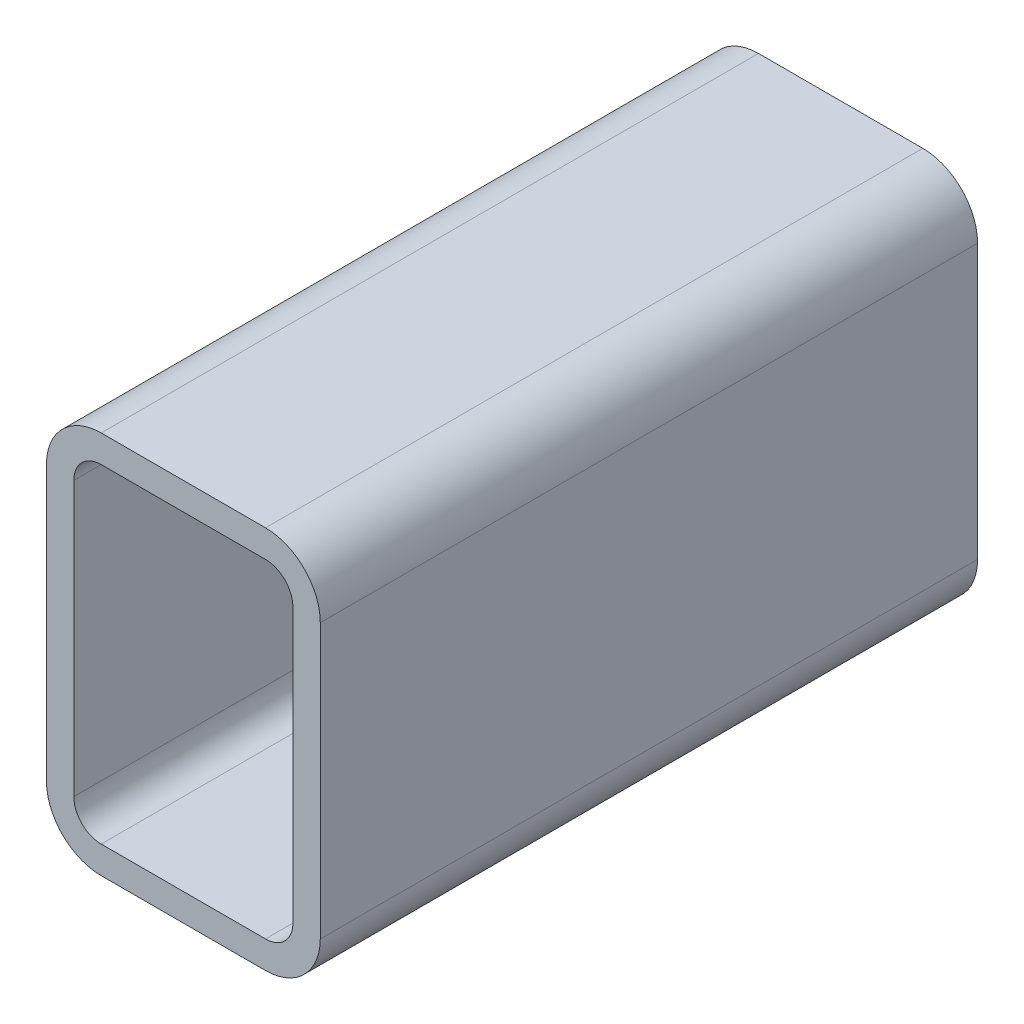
SolidWorks part; units mm, degrees
ref_plane "Front Plane" through (0, 0, 0) normal (0, 0, 1) x (1, 0, 0)
ref_plane "Top Plane" through (0, 0, 0) normal (0, 1, 0) x (1, 0, 0)
ref_plane "Right Plane" through (0, 0, 0) normal (1, 0, 0) x (0, 0, -1)
sketch "Sketch1" plane through (0, 0, 0) normal (0, 0, 1) x (1, 0, 0)
sketch_block_instance "HSS7x5x0.500-1"
sketch_block "HSS7x5x0.500"
extrude "Boss-Extrude1" add sketch "Sketch1" along normal blind 304.8
